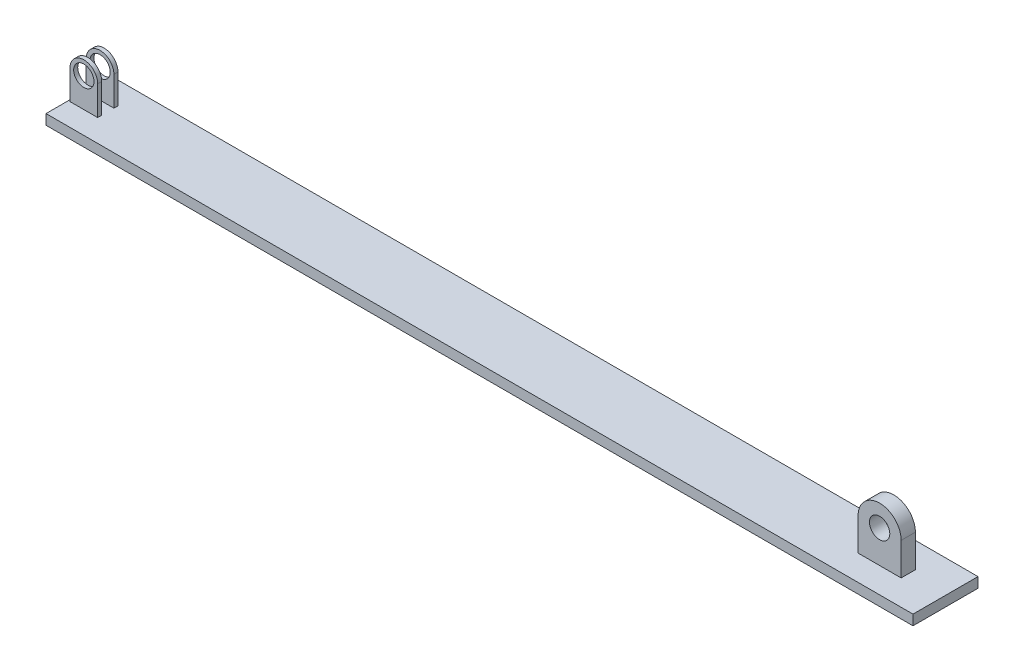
SolidWorks part; units mm, degrees
ref_plane "Front Plane" through (0, 0, 0) normal (0, 0, 1) x (1, 0, 0)
ref_plane "Top Plane" through (0, 0, 0) normal (0, 1, 0) x (1, 0, 0)
ref_plane "Right Plane" through (0, 0, 0) normal (1, 0, 0) x (0, 0, -1)
sketch "Sketch1" plane through (0, 0, 0) normal (0, 0, -1) x (1, 0, 0)
  line L0 (0, -17.3848) -> (0, 17.3848) construction
  line L1 (0, 2.5) -> (426.72, 2.5)
  line L2 (0, 2.5) -> (0, -2.5)
  line L3 (0, -2.5) -> (426.72, -2.5)
  line L4 (426.72, 2.5) -> (426.72, -2.5)
  line L5 (426.72, 0) -> (0, 0) construction
  dimension "D1" = 5
  dimension "D2" = 426.72
extrude "Extrude2" add sketch "Sketch1" along normal mid plane 32
sketch "Sketch2" plane through (0, 0, 0) normal (0, 0, 1) x (1, 0, 0)
  line L0 (7.6165, 2.5) -> (7.6165, 11.837) construction
  line L1 (0, 2.5) -> (426.72, 2.5) construction
  line L2 (0.8031, 2.5) -> (0.8031, 16.9215)
  line L3 (14.4299, 2.5) -> (14.4299, 16.9215)
  line L4 (0.8031, 2.5) -> (14.4299, 2.5)
  arc A0 (0.8031, 16.9215) -> (14.4299, 16.9215) centre (7.6165, 16.9215) cw
  circle A1 centre (7.6165, 16.9215) radius 5
  dimension "D1" = 10
extrude "Extrude3" add sketch "Sketch2" along normal mid plane 10
sketch "Sketch3" plane through (0.8031, 0, 0) normal (-1, 0, 0) x (0, 0, 1)
  line L0 (-16, 2.5) -> (16, 2.5) construction
  line L1 (-3, 2.5) -> (3, 2.5)
  line L2 (-3, 2.5) -> (-3, 43.4954)
  line L3 (-3, 43.4954) -> (3, 43.4954)
  line L4 (3, 2.5) -> (3, 43.4954)
  line L5 (0, 43.4954) -> (0, 2.5) construction
  line L6 (0, -17.3848) -> (0, 17.3848) construction
  dimension "D1" = 6
extrude "Cut-Extrude1" cut sketch "Sketch3" against normal up to surface (13.6268 mm away)
sketch "Sketch4" plane through (0, 0, 0) normal (0, 0, 1) x (1, 0, 0)
  line L0 (397.8057, 2.5) -> (397.8057, 18.5157) construction
  line L1 (0, 2.5) -> (426.72, 2.5) construction
  line L2 (408.3986, 2.5) -> (408.3986, 18.5157)
  line L3 (387.2127, 2.5) -> (387.2127, 18.5157)
  line L4 (387.2127, 2.5) -> (408.3986, 2.5)
  arc A0 (408.3986, 18.5157) -> (387.2127, 18.5157) centre (397.8057, 18.5157) ccw
  circle A1 centre (397.8057, 18.5157) radius 5
  dimension "D1" = 10
extrude "Extrude4" add sketch "Sketch4" along normal mid plane 7
